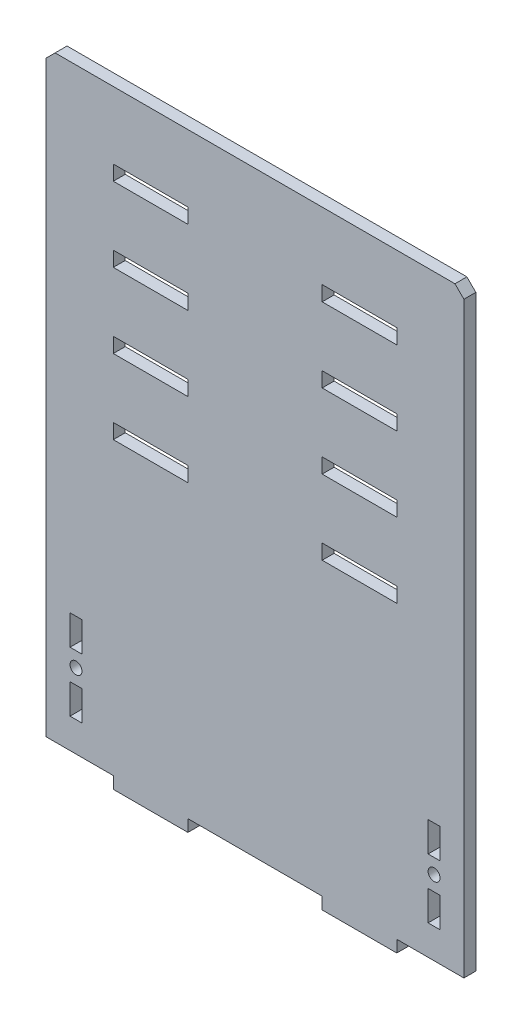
SolidWorks part; units mm, degrees
ref_plane "Front Plane" through (0, 0, 0) normal (0, 0, 1) x (1, 0, 0)
ref_plane "Top Plane" through (0, 0, 0) normal (0, 1, 0) x (1, 0, 0)
ref_plane "Right Plane" through (0, 0, 0) normal (1, 0, 0) x (0, 0, -1)
sketch "Sketch1" plane through (0, 0, 0) normal (0, 0, 1) x (1, 0, 0)
  line L0 (-70, 97) -> (-67, 100)
  line L1 (-67, 100) -> (67, 100)
  line L2 (-70, 97) -> (-70, -100)
  line L3 (-70, -100) -> (70, -100)
  line L4 (70, 97) -> (70, -100)
  line L5 (-70, 100) -> (70, -100) construction
  line L6 (-70, -100) -> (70, 100) construction
  line L7 (67, 100) -> (70, 97)
  point P0 (0, 0)
  dimension "D1" = 140
  dimension "D2" = 200
extrude "Boss-Extrude1" add sketch "Sketch1" against normal blind 4
sketch "Sketch2" plane through (0, 0, 0) normal (0, 0, 1) x (1, 0, 0)
  line L0 (0, 100) -> (0, -100) construction
  line L1 (67, 100) -> (-67, 100) construction
  line L2 (-70, -100) -> (70, -100) construction
  line L3 (22.5, -100) -> (22.5, -104)
  line L4 (-47.5, -100) -> (-22.5, -100)
  line L5 (-47.5, -100) -> (-47.5, -104)
  line L6 (-47.5, -104) -> (-22.5, -104)
  line L7 (-22.5, -100) -> (-22.5, -104)
  line L8 (47.5, -104) -> (22.5, -104)
  line L9 (47.5, -100) -> (47.5, -104)
  line L10 (47.5, -100) -> (22.5, -100)
  point P14 (35, -100)
  point P15 (-35, -100)
  dimension "D1" = 25
  dimension "D2" = 70
  dimension "D3" = 4
extrude "Boss-Extrude2" add sketch "Sketch2" against normal blind 4
sketch "Sketch3" plane through (0, 0, 0) normal (0, 0, 1) x (1, 0, 0)
  line L0 (22.5, -2.5) -> (47.5, -2.5)
  line L1 (-47.5, -2.5) -> (-22.5, -2.5)
  line L2 (-47.5, -2.5) -> (-47.5, 2.5)
  line L3 (-47.5, 2.5) -> (-22.5, 2.5)
  line L4 (-22.5, -2.5) -> (-22.5, 2.5)
  line L5 (-47.5, -2.5) -> (-22.5, 2.5) construction
  line L6 (-47.5, 2.5) -> (-22.5, -2.5) construction
  line L7 (22.5, -2.5) -> (22.5, 2.5)
  line L8 (22.5, 2.5) -> (47.5, 2.5)
  line L9 (47.5, -2.5) -> (47.5, 2.5)
  line L10 (22.5, -2.5) -> (47.5, 2.5) construction
  line L11 (22.5, 2.5) -> (47.5, -2.5) construction
  line L12 (22.5, 22.5) -> (47.5, 22.5)
  line L13 (22.5, 22.5) -> (22.5, 27.5)
  line L14 (22.5, 27.5) -> (47.5, 27.5)
  line L15 (47.5, 22.5) -> (47.5, 27.5)
  line L16 (22.5, 22.5) -> (47.5, 27.5) construction
  line L17 (22.5, 27.5) -> (47.5, 22.5) construction
  line L18 (22.5, 47.5) -> (47.5, 47.5)
  line L19 (22.5, 47.5) -> (22.5, 52.5)
  line L20 (22.5, 52.5) -> (47.5, 52.5)
  line L21 (47.5, 47.5) -> (47.5, 52.5)
  line L22 (22.5, 47.5) -> (47.5, 52.5) construction
  line L23 (22.5, 52.5) -> (47.5, 47.5) construction
  line L24 (22.5, 72.5) -> (47.5, 72.5)
  line L25 (22.5, 72.5) -> (22.5, 77.5)
  line L26 (22.5, 77.5) -> (47.5, 77.5)
  line L27 (47.5, 72.5) -> (47.5, 77.5)
  line L28 (22.5, 72.5) -> (47.5, 77.5) construction
  line L29 (22.5, 77.5) -> (47.5, 72.5) construction
  line L30 (-47.5, 22.5) -> (-22.5, 22.5)
  line L31 (-47.5, 22.5) -> (-47.5, 27.5)
  line L32 (-47.5, 27.5) -> (-22.5, 27.5)
  line L33 (-22.5, 22.5) -> (-22.5, 27.5)
  line L34 (-47.5, 22.5) -> (-22.5, 27.5) construction
  line L35 (-47.5, 27.5) -> (-22.5, 22.5) construction
  line L36 (-47.5, 47.5) -> (-22.5, 47.5)
  line L37 (-47.5, 47.5) -> (-47.5, 52.5)
  line L38 (-47.5, 52.5) -> (-22.5, 52.5)
  line L39 (-22.5, 47.5) -> (-22.5, 52.5)
  line L40 (-47.5, 47.5) -> (-22.5, 52.5) construction
  line L41 (-47.5, 52.5) -> (-22.5, 47.5) construction
  line L42 (-47.5, 72.5) -> (-22.5, 72.5)
  line L43 (-47.5, 72.5) -> (-47.5, 77.5)
  line L44 (-47.5, 77.5) -> (-22.5, 77.5)
  line L45 (-22.5, 72.5) -> (-22.5, 77.5)
  line L46 (-47.5, 72.5) -> (-22.5, 77.5) construction
  line L47 (-47.5, 77.5) -> (-22.5, 72.5) construction
  line L48 (-35, 0) -> (35, 0) construction
  line L49 (-35, 0) -> (-35, 25) construction
  line L50 (-70, -100) -> (-47.5, -100) construction
  point P0 (-35, 0)
  point P7 (35, 0)
  point P13 (35, 25)
  point P18 (35, 50)
  point P23 (35, 75)
  point P28 (-35, 25)
  point P33 (-35, 50)
  point P38 (-35, 75)
  dimension "D1" = 25
  dimension "D2" = 5
  dimension "D3" = 35
  dimension "D6" = 70
  dimension "D7" = 25
  dimension "D8" = 100
  dimension "D4" = 2
  dimension "D5" = 4
extrude "Cut-Extrude1" cut sketch "Sketch3" against normal through all both and the other way through all
sketch "Sketch4" plane through (0, 0, 0) normal (0, 0, 1) x (1, 0, 0)
  line L0 (-70, -100) -> (-47.5, -100) construction
  line L1 (-62, -90) -> (-58, -90)
  line L2 (-62, -90) -> (-62, -80)
  line L3 (-62, -80) -> (-58, -80)
  line L4 (-58, -90) -> (-58, -80)
  line L5 (-62, -90) -> (-58, -80) construction
  line L6 (-62, -80) -> (-58, -90) construction
  line L7 (-70, 97) -> (-70, -100) construction
  line L8 (0, 100) -> (0, -100) construction
  line L9 (67, 100) -> (-67, 100) construction
  line L10 (-22.5, -100) -> (22.5, -100) construction
  line L11 (58, -90) -> (62, -90)
  line L12 (58, -90) -> (58, -80)
  line L13 (58, -80) -> (62, -80)
  line L14 (62, -90) -> (62, -80)
  line L15 (58, -90) -> (62, -80) construction
  line L16 (58, -80) -> (62, -90) construction
  line L17 (58, -70) -> (62, -70)
  line L18 (58, -70) -> (58, -60)
  line L19 (58, -60) -> (62, -60)
  line L20 (62, -70) -> (62, -60)
  line L21 (58, -70) -> (62, -60) construction
  line L22 (58, -60) -> (62, -70) construction
  line L23 (-62, -70) -> (-58, -70)
  line L24 (-62, -70) -> (-62, -60)
  line L25 (-62, -60) -> (-58, -60)
  line L26 (-58, -70) -> (-58, -60)
  line L27 (-62, -70) -> (-58, -60) construction
  line L28 (-62, -60) -> (-58, -70) construction
  line L29 (-60, -85) -> (60, -85) construction
  line L30 (-60, -85) -> (-60, -65) construction
  circle A0 centre (-60, -75) radius 2
  circle A1 centre (60, -75) radius 2
  point P0 (-60, -85)
  point P18 (60, -85)
  point P23 (60, -65)
  point P28 (-60, -65)
  dimension "D9" = 4
  dimension "D1" = 10
  dimension "D2" = 4
  dimension "D3" = 15
  dimension "D4" = 10
  dimension "D7" = 120
  dimension "D8" = 20
  dimension "D5" = 2
  dimension "D6" = 2
extrude "Cut-Extrude2" cut sketch "Sketch4" against normal through all both and the other way through all
sketch "Sketch5" plane through (0, 0, 0) normal (0, 0, 1) x (1, 0, 0)
  line L0 (-47.5, 85) -> (-22.5, 85) construction
  line L1 (22.5, 85) -> (47.5, 85) construction
  line L2 (-47.2957, 72.5) -> (-70, 72.5) construction
  line L3 (-47.5, 72.5) -> (-22.5, 72.5) construction
  line L4 (-70, 97) -> (-70, -100) construction
  line L5 (-47.2957, 48.152) -> (-70, 48.152) construction
  line L6 (-47.2957, 48.152) -> (-70, 48.152) construction
  line L7 (67, 100) -> (-67, 100) construction
  line L8 (-47.2957, 23.152) -> (-70, 23.152) construction
  line L9 (-47.2957, 23.152) -> (-70, 23.152) construction
  line L10 (-47.2957, -1.848) -> (-70, -1.848) construction
  line L11 (-47.2957, -1.848) -> (-70, -1.848) construction
  text T0 "01" font "Century Gothic" height 5
  text T1 "02  " font "Century Gothic" height 5
  text T2 "03  " font "Century Gothic" height 5
  text T3 "04  " font "Century Gothic" height 5
  text T4 "A" font "Century Gothic" height 10
  text T5 "B" font "Century Gothic" height 10
  dimension "D1" = 15
